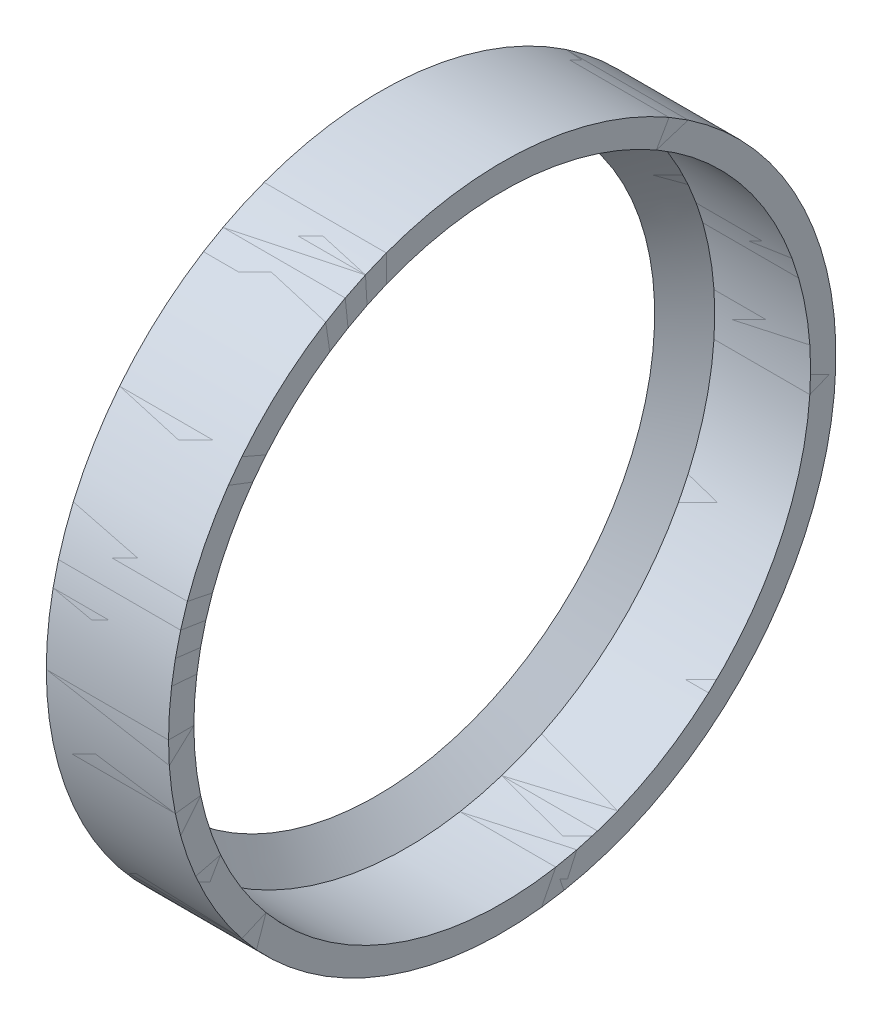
SolidWorks part; units mm, degrees
ref_plane "Front Plane" through (0, 0, 0) normal (0, 0, 1) x (1, 0, 0)
ref_plane "Top Plane" through (0, 0, 0) normal (0, 1, 0) x (1, 0, 0)
ref_plane "Right Plane" through (0, 0, 0) normal (1, 0, 0) x (0, 0, -1)
sketch "Sketch1" plane through (0, 0, 0) normal (0, 0, 1) x (1, 0, 0)
  line L1 (0.1, 9.225) -> (3.48, 9.225)
  line L5 (3.48, 9.225) -> (3.48, 8.525)
  line L6 (3.48, 8.525) -> (0.83, 8.525)
  line L7 (0.83, 8.525) -> (0, 7.695)
  line L9 (-1.6592, 0) -> (1.5965, 0) construction
  line L15 (0, 7.695) -> (0, 8.475)
  line L16 (0, 8.475) -> (0.1, 8.475)
  line L17 (0.1, 8.475) -> (0.1, 9.225)
  line L18 (0.1, -8.475) -> (0.1, -9.225)
  line L19 (0, -8.475) -> (0.1, -8.475)
  line L21 (0, -8.475) -> (0, -7.695)
  line L22 (0.83, -8.525) -> (0, -7.695)
  line L23 (3.48, -8.525) -> (0.83, -8.525)
  line L24 (3.48, -9.225) -> (3.48, -8.525)
  line L25 (0.1, -9.225) -> (3.48, -9.225)
revolve "Revolve1" add sketch "Sketch1" angle 360 about L9
